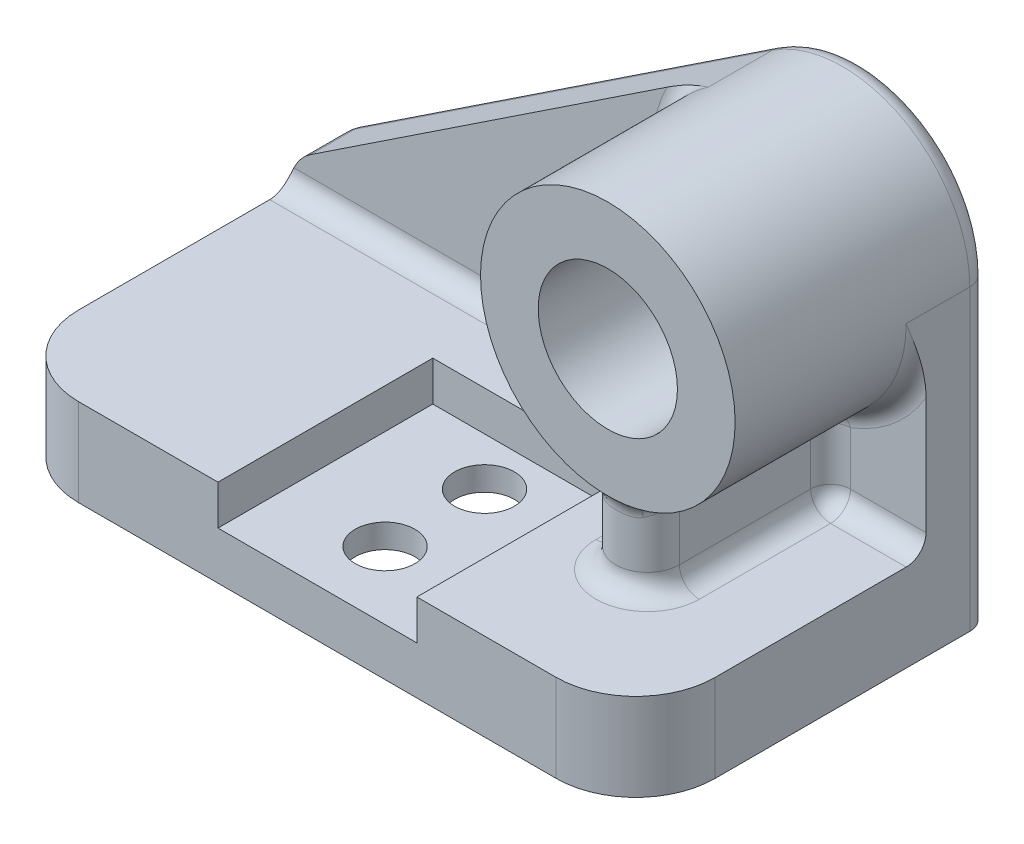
SolidWorks part; units mm, degrees
ref_plane "Front" through (0, 0, 0) normal (0, 0, 1) x (1, 0, 0)
ref_plane "Top" through (0, 0, 0) normal (0, 1, 0) x (1, 0, 0)
ref_plane "Right" through (0, 0, 0) normal (1, 0, 0) x (0, 0, -1)
sketch "Sketch1" plane through (0, 0, 0) normal (0, 1, 0) x (1, 0, 0)
  line L0 (0, 0) -> (160, 0)
  line L1 (0, 0) -> (0, 89)
  line L2 (160, 89) -> (0, 89)
  line L3 (160, 89) -> (160, 0)
  dimension "D3" = 89
  dimension "D4" = 160
extrude "Base_Plate" add sketch "Sketch1" along normal blind 22
fillet "Base_Fillet" radius 20 2 edges at (0, 11, 0) (160, 11, 0)
sketch "Sketch5" plane through (0, 22, 0) normal (0, 1, 0) x (-1, 0, 0)
  line L0 (-20, 0) -> (-140, 0) construction
  line L1 (-55, 0) -> (-105, 0)
  line L2 (-55, 0) -> (-55, -54)
  line L3 (-55, -54) -> (-105, -54)
  line L4 (-105, 0) -> (-105, -54)
  line L5 (-160, -89) -> (0, -89) construction
  line L6 (-80, 0) -> (-80, -89) construction
  dimension "D1" = 35
  dimension "D2" = 50
extrude "Cut-Extrude1" cut sketch "Sketch5" against normal blind 10
shell "Wall_Thickness" thickness 6
sketch "Sketch6" plane through (0, 12, 0) normal (0, 1, 0) x (-1, 0, 0)
  line L0 (-80, 0) -> (-80, -54) construction
  line L1 (-55, 0) -> (-105, 0) construction
  line L2 (-105, -54) -> (-55, -54) construction
  circle A0 centre (-80, -17) radius 7.5
  circle A1 centre (-80, -42) radius 7.5
  dimension "D1" = 15
  dimension "D2" = 12
  dimension "D3" = 25
extrude "Cut-Extrude2" cut sketch "Sketch6" against normal through all
sketch "Sketch2" plane through (0, 0, -89) normal (0, 0, -1) x (-1, 0, 0)
  line L1 (-20, 0) -> (-140, 0) construction
  line L2 (-160, 22) -> (0, 22) construction
  line L3 (-160, 22) -> (0, 22)
  line L4 (-160, 22) -> (-160, 0) construction
  line L5 (-160, 22) -> (-160, 75)
  line L6 (-5.3632, 31.9976) -> (-110.3018, 101.6603)
  arc A0 (-110.3018, 101.6603) -> (-160, 75) centre (-128, 75) ccw
  arc A1 (0, 22) -> (-5.3632, 31.9976) centre (-12, 22) ccw
  dimension "D1" = 64
  dimension "D4" = 12
  dimension "D2" = 75
extrude "Vertical_Plate" add sketch "Sketch2" against normal blind 16
ref_plane "Circular_Plane" through (0, 0, -100) normal (0, 0, -1) x (-1, 0, 0)
sketch "Sketch3" plane through (0, 0, -89) normal (0, 0, -1) x (-1, 0, 0)
  circle A0 centre (-128, 75) radius 32
  arc A1 (-110.3018, 101.6603) -> (-160, 75) centre (-128, 75) ccw construction
extrude "Circular_Boss" add sketch "Sketch3" against normal blind 64
sketch "Sketch4" plane through (0, 22, 0) normal (0, 1, 0) x (-1, 0, 0)
  line L0 (-96, -25) -> (-160, -25) construction
  line L1 (-96, -73) -> (-160, -73) construction
  line L2 (-120, -73) -> (-120, -35)
  line L3 (-128, -73) -> (-128, -89) construction
  line L5 (-136, -73) -> (-136, -35)
  line L7 (-136, -73) -> (-120, -73)
  arc A0 (-136, -35) -> (-120, -35) centre (-128, -35) cw
  dimension "D1" = 2
  dimension "D2" = 8
extrude "Rib_Under" add sketch "Sketch4" along normal up to next
fillet "Rib_Fillet" radius 5 7 edges at (136, 22, -54) (136, 44.0161, -54) (128.8079, 43.0102, -27.0409) (120, 44.0161, -54) (120, 22, -54) (128, 22, -27)
fillet "Circ_Fillet" radius 5 18 edges at (136, 33.6795, -73) (136.89, 43.2065, -73) (137.4645, 23.4645, -73) (96.206, 71.3753, -73) (120, 33.6795, -73) (119.11, 43.2065, -73) (118.5355, 23.4645, -73) (160, 37.5, -89) (0, 11, -89) (1.4255, 27.6726, -89) (57.8325, 66.829, -89) (143.1271, 103.1988, -89) (154.3038, 56.7762, -73)
sketch "Sketch7" plane through (0, 0, -25) normal (0, 0, 1) x (1, 0, 0)
  circle A0 centre (128, 75) radius 17.5
  dimension "D1" = 35
extrude "Cut-Extrude3" cut sketch "Sketch7" against normal through all
